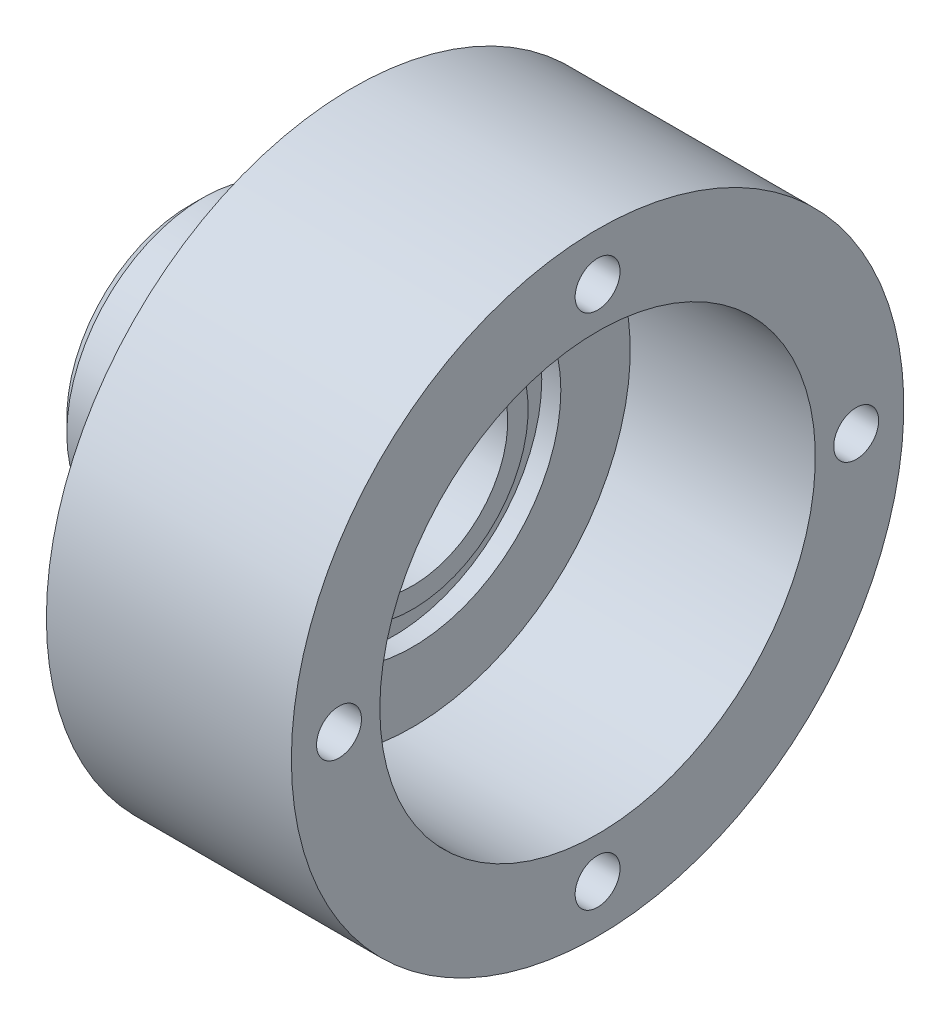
SolidWorks part; units mm, degrees
ref_plane "Plan de face" through (0, 0, 0) normal (0, 0, 1) x (1, 0, 0)
ref_plane "Plan de dessus" through (0, 0, 0) normal (0, 1, 0) x (1, 0, 0)
ref_plane "Plan de droite" through (0, 0, 0) normal (1, 0, 0) x (0, 0, -1)
sketch "Esquisse1" plane through (0, 0, 0) normal (0, 0, 1) x (1, 0, 0)
  line L0 (0, 7) -> (0, 10)
  line L1 (0, 10) -> (10, 10)
  line L2 (10, 10) -> (10, 9)
  line L3 (10, 9) -> (12, 9)
  line L4 (12, 9) -> (12, 11.15)
  line L5 (12, 22.5) -> (30, 22.5)
  line L6 (30, 22.5) -> (30, 16)
  line L8 (-25.5557, 0) -> (44.582, 0) construction
  line L9 (12, 11.15) -> (13.4, 11.15)
  line L10 (13.4, 11.15) -> (13.4, 13.95)
  line L11 (13.4, 13.95) -> (12, 13.95)
  line L12 (12, 13.95) -> (12, 22.5)
  line L13 (16.4, 7) -> (0, 7)
  line L14 (16.4, 7) -> (16.4, 8.5)
  line L15 (16.4, 8.5) -> (15, 8.5)
  line L16 (15, 8.5) -> (15, 10.9)
  line L17 (15, 10.9) -> (16.4, 10.9)
  line L18 (16.4, 10.9) -> (16.4, 16)
  line L19 (16.4, 16) -> (30, 16)
  dimension "D1" = 10
  dimension "D2" = 2
  dimension "D3" = 30
  dimension "D4" = 13.95
  dimension "D5" = 11.15
  dimension "D6" = 10
  dimension "D8" = 9
  dimension "D9" = 8.5
  dimension "D10" = 10.9
  dimension "D11" = 1.4
  dimension "D12" = 1.4
  dimension "D13" = 1.4
  dimension "D14" = 1.4
  dimension "D15" = 16
revolve "Révolution1" add sketch "Esquisse1" angle 360 about L8
hole_wizard "Trou taraudé M4x0.71" positions "Esquisse3" profile "Esquisse2" tap size "M4x0.7" standard "Ansi Métrique"
sketch "Esquisse3" plane through (30, 0, 0) normal (1, 0, 0) x (0, 0, -1)
  circle A0 centre (0, 0) radius 19
  point P0 (0, 19)
  point P1 (19, 0)
  point P3 (0, -19)
  point P5 (-19, 0)
  dimension "D1" = 38
sketch "Esquisse2" plane through (30, 19, 0) normal (0, 1, 0) x (0, 0, -1)
  line L0 (0, 0) -> (0, 12.9914)
  line L1 (0, 12.9914) -> (1.65, 12)
  line L2 (1.65, 12) -> (1.65, 0)
  line L5 (1.65, 0) -> (0, 0)
  line L10 (0, 12.9914) -> (-1.65, 12) construction
  line L11 (0, -6.35) -> (0, 107.95) construction
  dimension "Diamètre du trou pour taraudage" = 3.3
  dimension "Profondeur du trou pour taraudage" = 12
  dimension "Angle de pointe" = 118
chamfer "Chanfrein1" distance 1 angle 45 2 edges at (10, 0, 10) (0, 0, 10)
